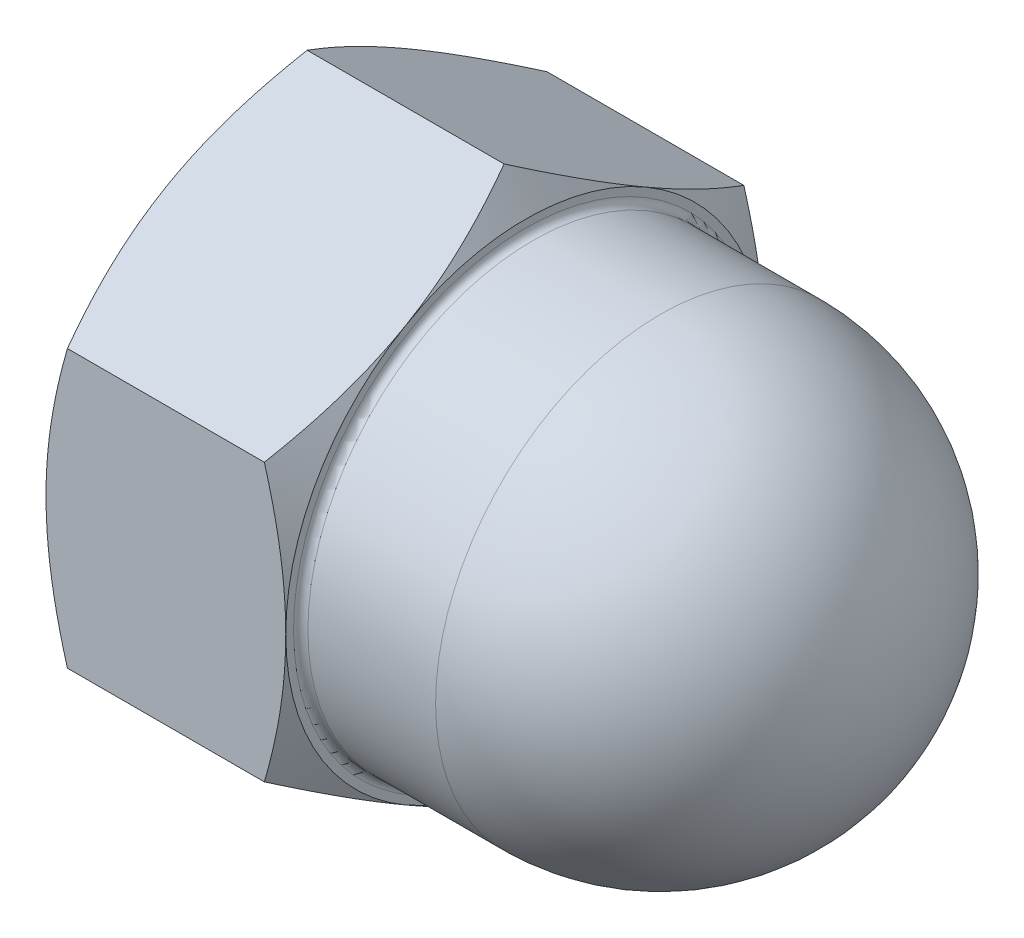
SolidWorks part; units mm, degrees
ref_plane "Plane1" through (0, 0, 0) normal (0, 0, 1) x (1, 0, 0)
ref_plane "Plane2" through (0, 0, 0) normal (0, 1, 0) x (1, 0, 0)
ref_plane "Plane3" through (0, 0, 0) normal (1, 0, 0) x (0, 0, -1)
revolve "EndChamfer" cut sketch "EndChamferSketch" angle 360 about L4
sketch "EndChamferSketch" plane through (0, 0, 0) normal (0, 0, 1) x (1, 0, 0)
  line L0 (-0.0254, 2.5) -> (0.0254, 2.5)
  line L1 (0.0254, 2.5) -> (0.3335, 2.06)
  line L2 (0.3335, 2.06) -> (-0.0254, 2.06)
  line L3 (-0.0254, 2.06) -> (-0.0254, 2.5)
  line L4 (0, 0) -> (-15.875, 0) construction
  dimension "D1" = 0.0508
  dimension "D2" = 35
  dimension "D3" = 0.0254
  dimension "ChamferDepth" = 0.44
  dimension "ThreadMajor" = 2.5
extrude "BaseNut" add sketch "BaseNutSke" along normal blind 4
sketch "BaseNutSke" plane through (0, 0, 0) normal (1, 0, 0) x (0, 0, -1)
  line L6 (4, 2.3094) -> (4, -2.3094)
  line L7 (-4, 2.3094) -> (-4, -2.3094)
  line L8 (4, 2.3094) -> (0, 4.6188)
  line L9 (0, 4.6188) -> (-4, 2.3094)
  line L10 (-4, -2.3094) -> (0, -4.6188)
  line L11 (0, -4.6188) -> (4, -2.3094)
  dimension "D4" = 60
  dimension "D1" = 120
  dimension "D2" = 4
  dimension "D3" = 4
  dimension "Width_flats" = 8
sketch "DomeSke" plane through (0, 0, 0) normal (0, 0, 1) x (1, 0, 0)
  line L0 (0, 0) -> (63.5, 0) construction
  line L1 (0, 2.3094) -> (0, -2.3094) construction
  line L2 (10, 0) -> (0, 0)
  line L3 (0, 3.75) -> (6.25, 3.75)
  line L4 (0, -3.75) -> (22.225, -14) construction
  line L5 (0, 3.75) -> (0, 0)
  arc A0 (6.25, 3.75) -> (10, 0) centre (6.25, 0) cw
  dimension "Dome_rad" = 3.75
  dimension "Overall_ht" = 10
revolve "Dome" add sketch "DomeSke" angle 360 about L0
sketch "Sketch4" plane through (0, 0, 0) normal (0, 0, 1) x (1, 0, 0)
  line L0 (0, 4) -> (0.7422, 5.2855)
  line L1 (4, 4) -> (3.2578, 5.2855)
  line L2 (0.7422, 5.2855) -> (3.2578, 5.2855)
  line L3 (4, 4) -> (6, 4)
  line L4 (6, 4) -> (6, 19)
  line L5 (6, 19) -> (-2, 19)
  line L6 (0, 4) -> (-2, 4)
  line L7 (-2, 4) -> (-2, 19)
  line L8 (4, 4.6188) -> (4, 2.3094) construction
  line L9 (0, 4.6188) -> (0, 2.3094) construction
  line L10 (0, 0) -> (57.15, 0) construction
  line L11 (4, 4.6188) -> (0, 4.6188) construction
  point P17 (4, 4)
  dimension "D1" = 30
  dimension "D2" = 30
  dimension "D3" = 2
  dimension "D4" = 2
  dimension "D5" = 0.6667
  dimension "D6" = 15
  dimension "D7" = 4
revolve "DoubleChamfer" cut sketch "Sketch4" angle 360 about L10
sketch "TapDriSke" plane through (0, 0, 0) normal (0, 0, 1) x (1, 0, 0)
  line L0 (0, 0) -> (44.45, 0) construction
  line L1 (0, 2.1) -> (6.5, 2.1)
  line L2 (0, 3.4641) -> (0, 0) construction
  line L3 (6.5, 2.1) -> (7.7618, 0)
  line L4 (0, 0) -> (63.5, 0) construction
  line L5 (7.7618, 0) -> (0, 0)
  line L6 (0, 0) -> (0, 2.1)
  line L7 (6.5, -2.1) -> (7.7618, 0) construction
  line L8 (0, -2.1) -> (6.5, -2.1) construction
  line L9 (1, 6.35) -> (1, 3.175) construction
  dimension "TPA" = 118
  dimension "Thread_min" = 4.2
  dimension "Drill_depth" = 6.5
  dimension "Drill_clr" = 2
revolve "TapDrill" cut sketch "TapDriSke"
revolve "Undercut" cut sketch "UcutSke" angle 360 about L0
sketch "UcutSke" plane through (0, 0, 0) normal (0, 0, 1) x (1, 0, 0)
  line L0 (0, 0) -> (38.1, 0) construction
  line L1 (5.3554, 2.525) -> (5.11, 2.1)
  line L2 (5.11, 0.25) -> (6.71, 0.25)
  line L3 (6.71, 0.25) -> (6.71, 2.525)
  line L4 (6.71, 2.525) -> (5.3554, 2.525)
  line L5 (5.11, 0.25) -> (5.11, 2.1)
  line L6 (6.5, 2.1) -> (0, 2.1) construction
  line L7 (0, 3.4641) -> (0, 0) construction
  dimension "D1" = 0.5
  dimension "D2" = 240
  dimension "Ucut_dia" = 5.05
  dimension "Ucut_dep" = 6.71
  dimension "Ucut_wid" = 1.6
sketch "ThdSchSke" plane through (0, 0, 0) normal (0, 1, 0) x (1, 0, 0)
  line L0 (0.0381, 2.5) -> (-0.242, 2.1)
  line L1 (-0.242, 2.1) -> (-0.242, 1.05)
  line L2 (-0.242, 1.05) -> (0.3182, 1.05)
  line L3 (0.3182, 1.05) -> (0.3182, 2.1)
  line L4 (0.3182, 2.1) -> (0.0381, 2.5)
  line L5 (-38.1, 0) -> (3.175, 0) construction
  line L6 (0, 0) -> (-15.875, 0) construction
  line L7 (0, 0) -> (63.5, 0) construction
  line L9 (0.8381, -7.025) -> (0.8381, -13.375) construction
  dimension "D1" = 0.0381
  dimension "VeeAngle" = 70
  dimension "SideAngle" = 55
  dimension "Thread_major" = 5
  dimension "Tap_drill" = 4.2
  dimension "OverCut" = 2.1
  dimension "Advance" = 0.8
revolve "ThreadSchematic" cut sketch "ThdSchSke" angle 360 about L5
pattern_linear "ThdSchPat"
fillet "DomeFillet" radius 0.12 1 edges at (4, 0, 3.75)
equation "' \"Width_flats@BaseNutSke\" = 30"
equation "' \"Hex_ht@BaseNut\" = 16"
equation "' \"Overall_ht@DomeSke\" = 34"
equation "' \"Dome_rad@DomeSke\" = 14"
equation "' \"Thread_min@TapDriSke\" = 17.5"
equation "' \"Drill_clr@TapDriSke\" = 5.0"
equation "' \"Advance@ThdSchSke\" = 2.5"
equation "' \"Thread_nominal@ThreadCosmetic\" = 20"
equation "' \"Radius@DomeFillet\" = 0.5"
equation "' \"Ucut_wid@UcutSke\" = 9.3"
equation "' \"Ucut_dep@UcutSke\" = 26.42"
equation "\"Drill_depth@TapDriSke\" = \"Overall_ht@DomeSke\"  - \"Drill_clr@TapDriSke\" - 0.3 * \"Thread_nominal@ThreadCosmetic\""
equation "\"Ucut_dia@UcutSke\" = \"Thread_nominal@ThreadCosmetic\" * 1.01"
equation "\"Thread_depth@ThreadCosmetic\" = \"Ucut_dep@UcutSke\" - \"Ucut_wid@UcutSke\" + ( \"Thread_nominal@ThreadCosmetic\" - \"Thread_min@TapDriSke\" ) / 2 * 0.57735"
equation "\"D2@BaseNutSke\" = \"Width_flats@BaseNutSke\" / 2"
equation "\"D3@BaseNutSke\" = \"Width_flats@BaseNutSke\" / 2"
equation "\"D7@Sketch4\" = \"Width_flats@BaseNutSke\" / 2"
equation "\"D5@Sketch4\" = \"Width_flats@BaseNutSke\" / 12"
equation "\"Thread_major@ThdSchSke\" = \"Thread_nominal@ThreadCosmetic\""
equation "\"Tap_drill@ThdSchSke\" = \"Thread_min@TapDriSke\""
equation "\"Overcut@ThdSchSke\" = \"Tap_drill@ThdSchSke\" * 0.5"
equation "\"Num_threads@ThdSchPat\" = int(  ( \"Thread_depth@ThreadCosmetic\" - 0.002 ) / \"Advance@ThdSchSke\" + 0.999 )  + 1"
equation "\"Advance@ThdSchPat\" = ( \"Thread_depth@ThreadCosmetic\" - 0.002 ) /  (\"Num_threads@ThdSchPat\" - 1) 'relax it"
equation "\"ThreadMajor@EndChamferSketch\" = \"Thread_nominal@ThreadCosmetic\" * 0.5"
equation "\"ChamferDepth@EndChamferSketch\" = (\"Thread_nominal@ThreadCosmetic\" - \"Thread_min@TapDriSke\") * 0.55"
